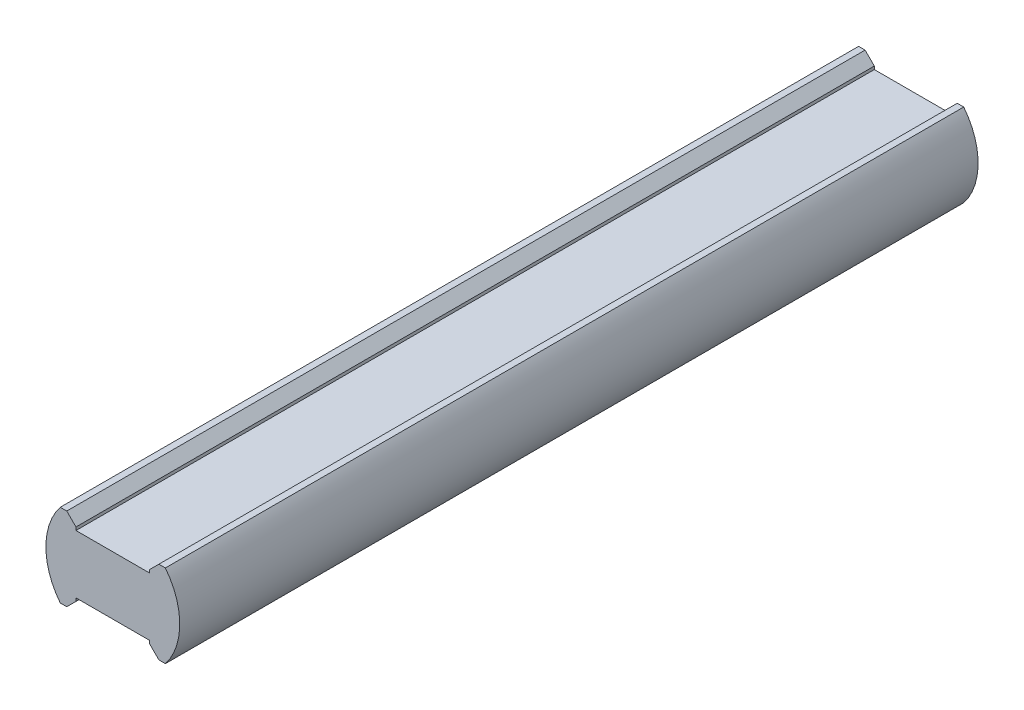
SolidWorks part; units mm, degrees
ref_plane "前基準面" through (0, 0, 0) normal (0, 0, 1) x (1, 0, 0)
ref_plane "上基準面" through (0, 0, 0) normal (0, 1, 0) x (1, 0, 0)
ref_plane "右基準面" through (0, 0, 0) normal (1, 0, 0) x (0, 0, -1)
sketch "草圖1" plane through (0, 0, 0) normal (0, 0, 1) x (1, 0, 0)
  line L2 (0, 6.5) -> (0, -6.5) construction
  line L3 (-10.2346, 3.75) -> (10.2346, 3.75) construction
  line L5 (-10.2346, -3.75) -> (10.2346, -3.75) construction
  line L6 (10.2346, 3.75) -> (10.2346, -3.75) construction
  line L8 (-6, 5.25) -> (-6, 4.75)
  line L9 (-6, 4.75) -> (6, 4.75)
  line L10 (6, 5.25) -> (6, 4.75)
  line L12 (-6, -5.25) -> (-6, -4.75)
  line L13 (-6, -4.75) -> (6, -4.75)
  line L14 (6, -5.25) -> (6, -4.75)
  line L15 (-8.5585, 6.75) -> (-7.5, 6.75)
  line L16 (7.5, 6.75) -> (8.5585, 6.75)
  line L17 (-8.5585, -6.75) -> (-7.5, -6.75)
  line L18 (7.5, -6.75) -> (8.5585, -6.75)
  line L19 (-7.5, 6.75) -> (-6, 5.25)
  line L20 (6, 5.25) -> (7.5, 6.75)
  line L21 (6, -5.25) -> (7.5, -6.75)
  line L22 (-7.5, -6.75) -> (-6, -5.25)
  arc A0 (-8.5585, 6.75) -> (-10.2346, 3.75) centre (0, 0) ccw
  arc A1 (-10.2346, -3.75) -> (-8.5585, -6.75) centre (0, 0) ccw
  arc A2 (8.5585, 6.75) -> (10.2346, 3.75) centre (0, 0) cw
  arc A3 (10.2346, -3.75) -> (8.5585, -6.75) centre (0, 0) cw
  arc A4 (10.2346, -3.75) -> (10.2346, 3.75) centre (0, 0) ccw
  arc A5 (-10.2346, -3.75) -> (-10.2346, 3.75) centre (0, 0) cw
  point P11 (-6, -6.75)
  point P12 (-6, 6.75)
  point P15 (6, 6.75)
  point P18 (6, -6.75)
  point P35 (0, -4.75)
  dimension "D1" = 10.9
  dimension "D2" = 7.5
  dimension "D3" = 3
  dimension "D4" = 1
  dimension "D5" = 1
  dimension "D6" = 12
  dimension "D7" = 3
extrude "填料-伸長1" add sketch "草圖1" along normal blind 130
